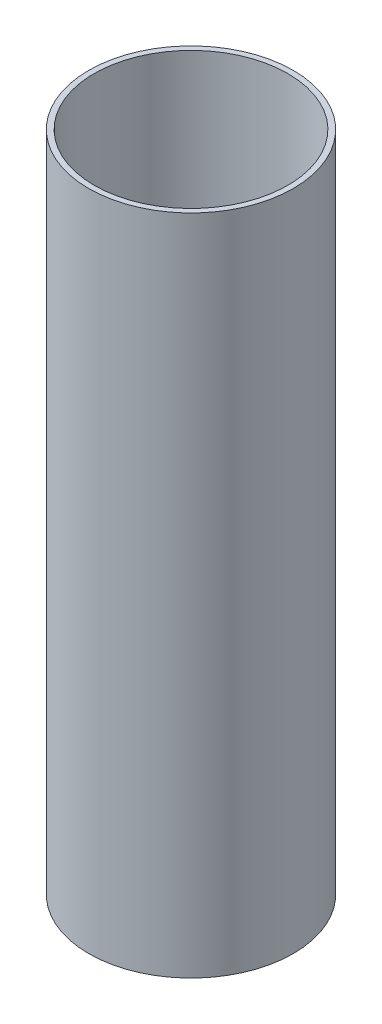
SolidWorks part; units mm, degrees
ref_plane "Front" through (0, 0, 0) normal (0, 0, 1) x (1, 0, 0)
ref_plane "Top" through (0, 0, 0) normal (0, 1, 0) x (1, 0, 0)
ref_plane "Right" through (0, 0, 0) normal (1, 0, 0) x (0, 0, -1)
sketch "Sketch1" plane through (0, 0, 0) normal (0, 1, 0) x (1, 0, 0)
  circle A0 centre (0, 0) radius 28.4353
  circle A1 centre (0, 0) radius 26.9113
  dimension "D1" = 56.8706
  dimension "D2" = 1.524
extrude "Boss-Extrude1" add sketch "Sketch1" along normal blind 184.15
sketch "Sketch2" plane through (0, 0, 0) normal (-1, 0, 0) x (0, 0, 1)
  line L0 (0, 184.15) -> (0, 0) construction
  line L1 (28.4353, 184.15) -> (-28.4353, 184.15) construction
  line L2 (-28.4353, 0) -> (28.4353, 0) construction
  line L3 (0, 0) -> (0, 25.4)
  line L4 (0, 25.4) -> (-28.4353, 25.4)
  line L6 (-28.4353, 25.4) -> (-28.4353, 0)
  line L7 (-28.4353, 0) -> (0, 0)
  line L8 (-28.4353, 184.15) -> (-28.4353, 0) construction
  dimension "D1" = 25.4
revolve "Cut-Revolve1" [suppressed] cut sketch "Sketch2" angle 210 mid plane about L0
fillet "Fillet1" [suppressed] radius 6.35
sketch "Sketch6" [suppressed] plane through (0, 0, 0) normal (1, 0, 0) x (0, 0, -1)
  line L0 (0, 198.12) -> (0, 38.1)
  line L1 (0, 210.82) -> (0, 25.4) construction
  line L2 (0, 38.1) -> (-39.974, 38.1)
  line L4 (-39.974, 38.1) -> (-39.974, 198.12)
  line L5 (-39.974, 198.12) -> (0, 198.12)
  line L6 (26.9113, 210.82) -> (-26.9113, 210.82) construction
  line L7 (-1.0401, 25.4) -> (28.4353, 25.4) construction
  dimension "D1" = 12.7
  dimension "D2" = 12.7
revolve "Cut-Revolve2" [suppressed] cut sketch "Sketch6" angle 90 mid plane about L0
fillet "Fillet3" [suppressed] radius 6.35
pattern_circular "CirPattern1" [suppressed] count 3 over 360
sketch "Sketch7" [suppressed] plane through (0, 0, 114.3) normal (0, 1, 0) x (-1, 0, 0)
  line L0 (13.4557, -90.9941) -> (14.2177, -89.6743)
  line L1 (0, -114.3) -> (24.6257, -100.0824)
  line L2 (0, -114.3) -> (0, -85.8647) construction
  line L3 (-13.4557, -90.9941) -> (-14.2177, -89.6743)
  line L4 (0, -114.3) -> (-24.6257, -100.0824)
  arc A0 (24.6257, -100.0824) -> (14.2177, -89.6743) centre (0, -114.3) ccw
  arc A1 (-24.6257, -100.0824) -> (-14.2177, -89.6743) centre (0, -114.3) cw
  circle A2 centre (0, -114.3) radius 28.4353 construction
  arc A3 (13.4557, -90.9941) -> (-13.4557, -90.9941) centre (0, -114.3) ccw
  circle A4 centre (0, -114.3) radius 26.9113 construction
  dimension "D1" = 30
  dimension "D2" = 60
extrude "Cut-Extrude4" [suppressed] cut sketch "Sketch7" along normal blind 3.175 flip side to cut contours A1 L4 L3 | L1 A0 L0
